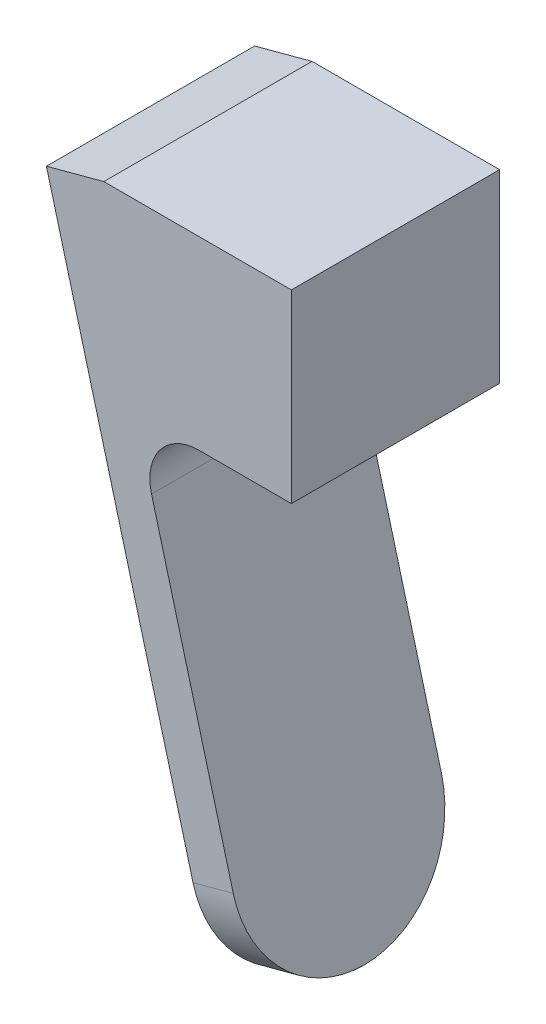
SolidWorks part; units mm, degrees
ref_plane "Front Plane" through (0, 0, 0) normal (0, 0, 1) x (1, 0, 0)
ref_plane "Top Plane" through (0, 0, 0) normal (0, 1, 0) x (1, 0, 0)
ref_plane "Right Plane" through (0, 0, 0) normal (1, 0, 0) x (0, 0, -1)
sketch "Sketch1" plane through (0, 0, 0) normal (0, 0, 1) x (1, 0, 0)
  line L0 (-8.2254, -3.6717) -> (0.6223, -36.6917)
  line L1 (-8.2254, -3.6717) -> (-5.2499, -2.8744)
  line L2 (-5.2499, -2.8744) -> (4.4746, -2.8744)
  line L3 (4.4746, -2.8744) -> (4.4746, -12.4701)
  line L4 (4.4746, -12.4701) -> (-3.6328, -12.4701)
  line L5 (0.6223, -36.6917) -> (2.8574, -36.6917)
  line L6 (2.8574, -36.6917) -> (-3.6328, -12.4701)
  dimension "D1" = 75
  dimension "D2" = 33.02
  dimension "D3" = 2.159
  dimension "D4" = 12.7
extrude "Boss-Extrude1" add sketch "Sketch1" along normal mid plane 10.795
fillet "Fillet1" radius 2.54 1 edges at (-3.6328, -12.4701, 0)
ref_plane "Plane1" through (-6.5069, -1.7435, 0) normal (0.9659, 0.2588, 0) x (0, 0, -1)
sketch "Sketch2" plane through (-6.5069, -1.7435, 0) normal (0.9659, 0.2588, 0) x (0, 0, -1)
  line L0 (-5.3975, -36.181) -> (5.3975, -36.181) construction
  line L1 (-5.3975, -36.181) -> (-5.3975, -14.4151) construction
  line L2 (5.3975, -36.181) -> (5.3975, -14.4151) construction
  line L3 (-5.3975, -30.7835) -> (-9.3518, -30.7835)
  line L4 (-9.3518, -30.7835) -> (-9.3518, -40.7425)
  line L5 (-9.3518, -40.7425) -> (7.7712, -40.7425)
  line L6 (7.7712, -40.7425) -> (7.7712, -30.7835)
  line L7 (7.7712, -30.7835) -> (5.3975, -30.7835)
  arc A0 (-5.3975, -30.7835) -> (5.3975, -30.7835) centre (0, -30.7835) ccw
extrude "Cut-Extrude1" cut sketch "Sketch2" against normal blind 10.795
